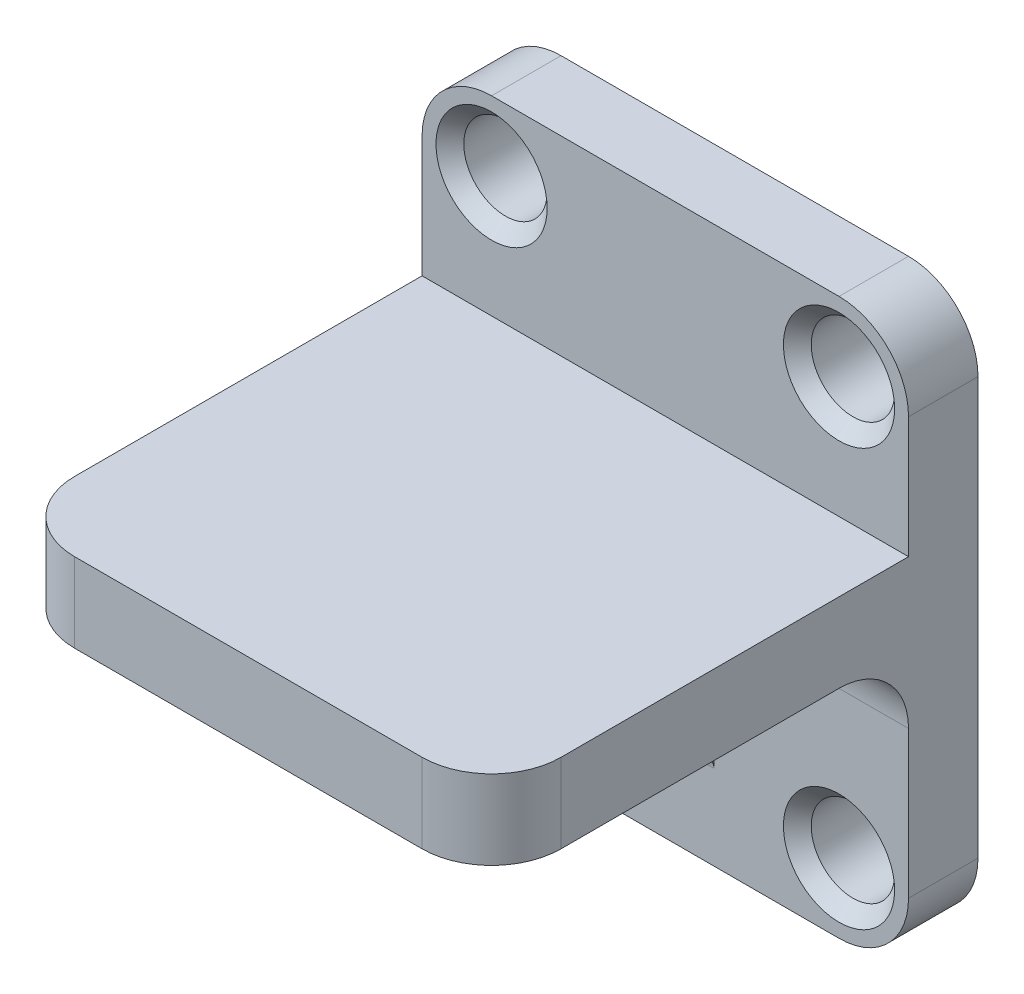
SolidWorks part; units mm, degrees
ref_plane "Alzado" through (0, 0, 0) normal (0, 0, 1) x (1, 0, 0)
ref_plane "Planta" through (0, 0, 0) normal (0, 1, 0) x (1, 0, 0)
ref_plane "Vista lateral" through (0, 0, 0) normal (1, 0, 0) x (0, 0, -1)
sketch "Croquis1" plane through (0, 0, 0) normal (0, 0, 1) x (1, 0, 0)
  line L1 (10, 0) -> (60, 0)
  line L2 (0, 10) -> (0, 70)
  line L3 (10, 80) -> (60, 80)
  line L4 (70, 10) -> (70, 70)
  arc A0 (70, 70) -> (60, 80) centre (60, 70) ccw
  arc A1 (0, 70) -> (10, 80) centre (10, 70) cw
  arc A2 (10, 0) -> (0, 10) centre (10, 10) cw
  arc A3 (60, 0) -> (70, 10) centre (60, 10) ccw
  circle A4 centre (10, 70) radius 6
  circle A5 centre (60, 70) radius 6
  circle A6 centre (10, 10) radius 6
  circle A7 centre (60, 10) radius 6
  point P7 (70, 80)
  point P10 (0, 80)
  point P13 (0, 0)
  dimension "D3" = 10
  dimension "D4" = 12
  dimension "D5" = 12
  dimension "D6" = 12
  dimension "D7" = 12
  dimension "D1" = 70
  dimension "D2" = 80
extrude "Extruir1" add sketch "Croquis1" along normal blind 10
sketch "Croquis2" plane through (0, 0, 10) normal (0, 0, 1) x (1, 0, 0)
  line L0 (0, 70) -> (0, 10) construction
  line L1 (0, 52.5637) -> (70, 52.5637)
  line L2 (0, 52.5637) -> (0, 41.1526)
  line L3 (0, 41.1526) -> (70, 41.1526)
  line L4 (70, 52.5637) -> (70, 41.1526)
  line L5 (70, 10) -> (70, 70) construction
extrude "Extruir2" add sketch "Croquis2" along normal blind 60
fillet "Redondeo1" radius 10
chamfer "Chaflán1" distance 2 angle 45
ref_plane "Plano1" through (35, 0, 0) normal (-1, 0, 0) x (0, 0, 1)
sketch "Croquis3" plane through (35, 0, 0) normal (-1, 0, 0) x (0, 0, 1)
  line L0 (65.4279, 44.8411) -> (4.1079, 10)
  line L1 (10, 10) -> (0, 10) construction
rib "Nervio1" sketch "Croquis3" sketch "Croquis3" thickness 14 extrusion direction parallel to sketch draft on no parameters "D1"=14
fillet "Redondeo2" radius 10
fillet "Redondeo3" radius 10
fillet "Redondeo4" radius 2
